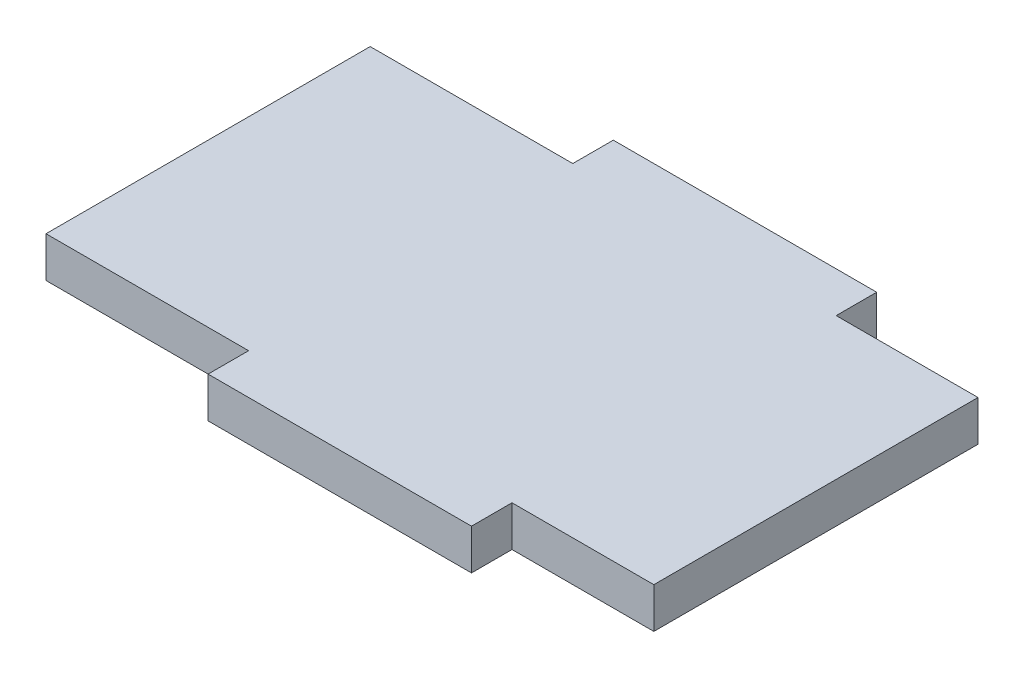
SolidWorks part; units mm, degrees
ref_plane "Front Plane" through (0, 0, 0) normal (0, 0, 1) x (1, 0, 0)
ref_plane "Top Plane" through (0, 0, 0) normal (0, 1, 0) x (1, 0, 0)
ref_plane "Right Plane" through (0, 0, 0) normal (1, 0, 0) x (0, 0, -1)
sketch "Sketch1" plane through (0, 0, 0) normal (0, 0, 1) x (1, 0, 0)
  line L0 (-2.5, -18.25) -> (7.5, -18.25) construction
  line L1 (6.5, -23.25) -> (-23.5, -23.25)
  line L2 (6.5, -23.25) -> (6.5, -21.25)
  line L3 (6.5, -21.25) -> (-23.5, -21.25)
  line L4 (-23.5, -23.25) -> (-23.5, -21.25)
  line L5 (33.5, -18.25) -> (33.5, -228.25) construction
extrude "Boss-Extrude1" add sketch "Sketch1" along normal up to surface (16 mm away)
sketch "Sketch2" plane through (0, 0, 0) normal (0, 0, -1) x (-1, 0, 0)
  line L0 (23.5, -23.25) -> (-6.5, -23.25) construction
  line L1 (13.5, -23.25) -> (0.5, -23.25)
  line L2 (13.5, -23.25) -> (13.5, -21.25)
  line L3 (13.5, -21.25) -> (0.5, -21.25)
  line L4 (0.5, -23.25) -> (0.5, -21.25)
  line L5 (-6.5, -21.25) -> (23.5, -21.25) construction
  dimension "D1" = 7
  dimension "D2" = 10
extrude "Boss-Extrude2" add sketch "Sketch2" along normal blind 2
sketch "Sketch3" plane through (0, 0, 16) normal (0, 0, 1) x (1, 0, 0)
  line L4 (-13.5, -21.25) -> (-13.5, -23.25)
  line L5 (-0.5, -21.25) -> (-13.5, -21.25)
  line L6 (-0.5, -23.25) -> (-0.5, -21.25)
  line L7 (-13.5, -23.25) -> (-0.5, -23.25)
  line L8 (-13.5, -21.25) -> (-13.5, -23.25)
  line L9 (-0.5, -21.25) -> (-13.5, -21.25)
  line L10 (-0.5, -23.25) -> (-0.5, -21.25)
  line L11 (-13.5, -23.25) -> (-0.5, -23.25)
  dimension "D1" = 0
extrude "Boss-Extrude3" add sketch "Sketch3" along normal blind 2
equation "\"anch\" = 2"
equation "\"alt\" = 100"
equation "\"pilanch\" = 100"
equation "\"pilalt\" = 250"
equation "\"bodyHeigh\" = 60"
equation "\"dorsalFinHeigh\" = 400"
equation "\"D2@Sketch1\"=\"anch\""
equation "\"D1@Boss-Extrude2\"=\"anch\""
equation "\"D1@Boss-Extrude3\"=\"anch\""
